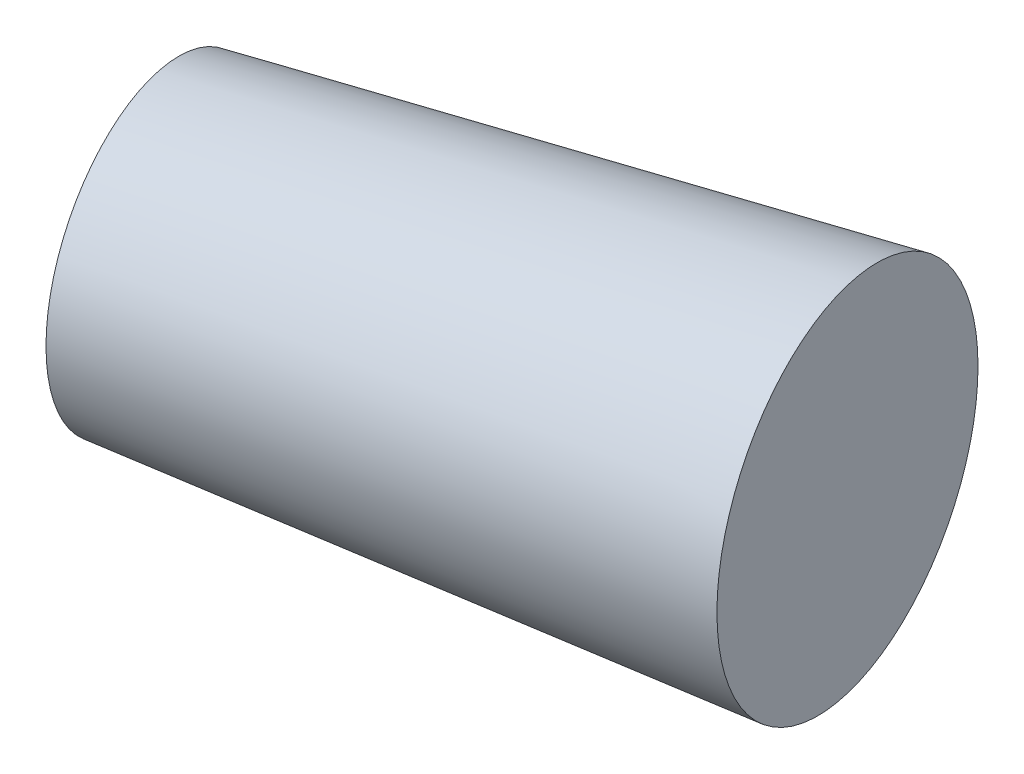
SolidWorks part; units mm, degrees
ref_plane "Plan1" through (0, 0, 0) normal (0, 0, 1) x (1, 0, 0)
ref_plane "Plan2" through (0, 0, 0) normal (0, 1, 0) x (1, 0, 0)
ref_plane "Plan3" through (0, 0, 0) normal (1, 0, 0) x (0, 0, -1)
sketch "Esquisse1" plane through (0, 0, 0) normal (0, 1, 0) x (1, 0, 0)
  line L1 (0, 0) -> (8.125, 1.9521) construction
  line L2 (0, 0) -> (8.125, 1.9521) construction
  line L4 (-5.9352, -4.3052) -> (-7.2432, 1.139) construction
  line L5 (-7.2432, 1.139) -> (3.2981, 4.2634) construction
  line L6 (4.875, -2.2998) -> (3.2981, 4.2634) construction
  line L7 (-6.5892, -1.5831) -> (4.0866, 0.9818)
  line L8 (-6.5892, -1.5831) -> (-7.2432, 1.139)
  line L9 (-7.2432, 1.139) -> (3.2981, 4.2634)
  line L10 (4.0866, 0.9818) -> (3.2981, 4.2634)
revolve "Base-Révolution" add sketch "Esquisse1" angle 360 about L2
